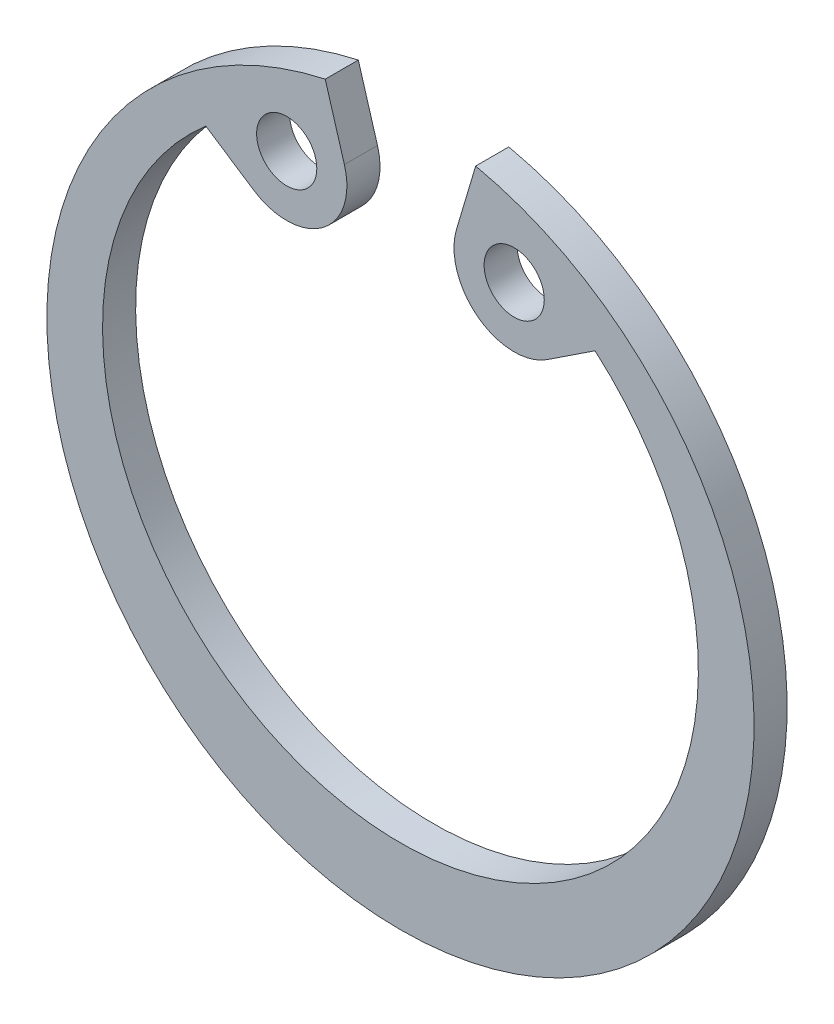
SolidWorks part; units mm, degrees
ref_plane "Plane1" through (0, 0, 0) normal (0, 0, 1) x (1, 0, 0)
ref_plane "Plane2" through (0, 0, 0) normal (0, 1, 0) x (1, 0, 0)
ref_plane "Plane3" through (0, 0, 0) normal (1, 0, 0) x (0, 0, -1)
sketch "Sketch1" plane through (0, 0, 0) normal (0, 0, 1) x (1, 0, 0)
  line L0 (-4.9005, 2.533) -> (-4.2633, 4.6729)
  line L1 (-13.2294, 1.3386) -> (-11.6444, 0.2928)
  line L2 (-0.2973, 1.3386) -> (-1.8822, 0.2928)
  line L3 (-6.7633, -6.8081) -> (-6.7633, 66.3581) construction
  line L4 (-8.6261, 2.533) -> (-9.2633, 4.6729)
  arc A0 (-9.2633, 4.6729) -> (-4.2633, 4.6729) centre (-6.7633, -6.8081) ccw
  arc A1 (-13.2294, 1.3386) -> (-0.2973, 1.3386) centre (-6.7633, -6.1581) ccw
  arc A2 (-11.6444, 0.2928) -> (-8.6261, 2.533) centre (-10.5429, 1.9622) ccw
  arc A3 (-1.8822, 0.2928) -> (-4.9005, 2.533) centre (-2.9837, 1.9622) cw
  circle A4 centre (-2.9837, 1.9622) radius 1
  circle A5 centre (-10.5429, 1.9622) radius 1
  dimension "D1" = 23.5
  dimension "D2" = 2.5
  dimension "D4" = 9.9
  dimension "D3" = 2
  dimension "D6" = 2
  dimension "D8" = 40
  dimension "D9" = 4.2
  dimension "D5" = 33.164
  dimension "D7" = 5
extrude "Base-Extrude" add sketch "Sketch1" along normal blind 1.1
